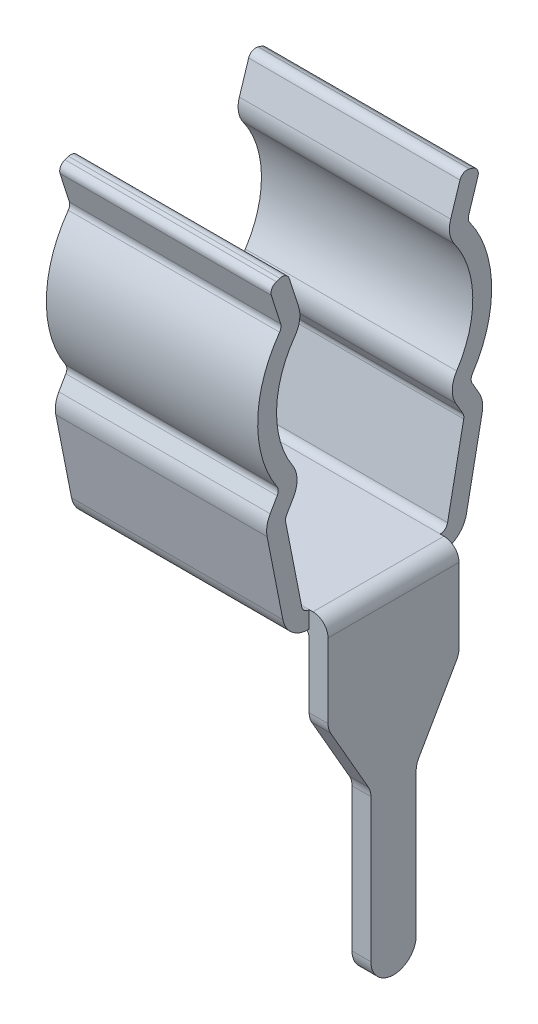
SolidWorks part; units mm, degrees
ref_plane "Plan de face" through (0, 0, 0) normal (0, 0, 1) x (1, 0, 0)
ref_plane "Plan de dessus" through (0, 0, 0) normal (0, 1, 0) x (1, 0, 0)
ref_plane "Plan de droite" through (0, 0, 0) normal (1, 0, 0) x (0, 0, -1)
sketch "Esquisse1" plane through (0, 0, 0) normal (1, 0, 0) x (0, 0, -1)
  line L0 (0, -44.9662) -> (0, 21.2612) construction
  line L1 (-24.6826, 0) -> (15.1517, 0) construction
  line L2 (-24.6826, 8.5) -> (15.1517, 8.5) construction
  line L3 (-24.6826, -8.5) -> (15.1517, -8.5) construction
  line L4 (11.7413, 5.4) -> (-3.8533, 5.4) construction
  line L5 (1.9, 11.6767) -> (1.9, -1.9759) construction
  line L6 (-1.9, 11.6767) -> (-1.9, -1.9759) construction
  line L7 (-1.9, 3.6704) -> (-3.7603, 0.4482) construction
  line L8 (-2.4394, 3.7362) -> (-4.4719, 0.2157) construction
  line L9 (4.6088, 0.4482) -> (-6.7435, 0.4482) construction
  line L10 (-2.5206, 3.5954) -> (-1.9, 0.4482) construction
  line L11 (-2.3212, 0) -> (-3.0082, 3.4838) construction
  line L12 (-1.9, 7.1748) -> (-2.3212, 8.5) construction
  line L13 (-2.3212, 8.5) -> (-5.9253, 7.3544) construction
  line L14 (-2.2658, 6.6752) -> (-2.8459, 8.5) construction
  line L15 (1.7458, 0) -> (-1.7458, 0)
  line L16 (-2.4326, 0.5646) -> (-2.8497, 2.6796)
  line L17 (-2.7691, 3.1651) -> (-2.5837, 3.4863)
  line L18 (-2.0146, 7.5352) -> (-2.2607, 8.3094)
  line L19 (2.7372, 8.1579) -> (2.4911, 7.3838)
  line L20 (-2.3591, 2.7764) -> (-1.9318, 0.6095)
  line L21 (-1.7356, 0.4482) -> (1.7356, 0.4482)
  line L22 (-2.5118, 8.4394) -> (-2.6071, 8.4091)
  line L23 (-2.7372, 8.1579) -> (-2.4911, 7.3838)
  line L24 (-2.1507, 3.2363) -> (-2.3361, 2.9151)
  line L25 (2.5118, 8.4394) -> (2.6071, 8.4091)
  line L26 (2.0146, 7.5352) -> (2.2607, 8.3094)
  line L27 (2.7691, 3.1651) -> (2.5837, 3.4863)
  line L28 (2.1507, 3.2363) -> (2.3361, 2.9151)
  line L29 (2.4326, 0.5646) -> (2.8497, 2.6796)
  line L30 (2.3591, 2.7764) -> (1.9318, 0.6095)
  arc A0 (-2.1128, 6.9152) -> (-2.1721, 3.971) centre (0, 5.4) ccw
  arc A1 (-2.5191, 7.2066) -> (-2.5898, 3.6962) centre (0, 5.4) ccw
  arc A2 (-1.9318, 0.6095) -> (-1.7356, 0.4482) centre (-1.7356, 0.6482) ccw
  arc A3 (-2.3361, 2.9151) -> (-2.3591, 2.7764) centre (-2.1629, 2.8151) ccw
  arc A4 (-2.5898, 3.6962) -> (-2.5837, 3.4863) centre (-2.7569, 3.5863) cw
  arc A5 (-2.5191, 7.2066) -> (-2.4911, 7.3838) centre (-2.6817, 7.3232) ccw
  arc A6 (-2.2607, 8.3094) -> (-2.5118, 8.4394) centre (-2.4513, 8.2488) ccw
  arc A7 (-2.6071, 8.4091) -> (-2.7372, 8.1579) centre (-2.5466, 8.2185) ccw
  arc A8 (-2.0146, 7.5352) -> (-2.1128, 6.9152) centre (-2.6817, 7.3232) cw
  arc A9 (-1.7458, 0) -> (-2.4326, 0.5646) centre (-1.7458, 0.7) cw
  arc A10 (-2.1721, 3.971) -> (-2.1507, 3.2363) centre (-2.7569, 3.5863) cw
  arc A11 (-2.8497, 2.6796) -> (-2.7691, 3.1651) centre (-2.1629, 2.8151) cw
  arc A12 (2.5191, 7.2066) -> (2.4911, 7.3838) centre (2.6817, 7.3232) cw
  arc A13 (2.6071, 8.4091) -> (2.7372, 8.1579) centre (2.5466, 8.2185) cw
  arc A14 (2.2607, 8.3094) -> (2.5118, 8.4394) centre (2.4513, 8.2488) cw
  arc A15 (2.0146, 7.5352) -> (2.1128, 6.9152) centre (2.6817, 7.3232) ccw
  arc A16 (2.5191, 7.2066) -> (2.5898, 3.6962) centre (0, 5.4) cw
  arc A17 (2.5898, 3.6962) -> (2.5837, 3.4863) centre (2.7569, 3.5863) ccw
  arc A18 (2.8497, 2.6796) -> (2.7691, 3.1651) centre (2.1629, 2.8151) ccw
  arc A19 (2.1128, 6.9152) -> (2.1721, 3.971) centre (0, 5.4) cw
  arc A20 (2.1721, 3.971) -> (2.1507, 3.2363) centre (2.7569, 3.5863) ccw
  arc A21 (2.3361, 2.9151) -> (2.3591, 2.7764) centre (2.1629, 2.8151) cw
  arc A22 (1.7458, 0) -> (2.4326, 0.5646) centre (1.7458, 0.7) ccw
  arc A23 (1.9318, 0.6095) -> (1.7356, 0.4482) centre (1.7356, 0.6482) cw
  point P43 (-2.3736, 2.85)
  point P49 (-2.4601, 7.2863)
  point P55 (-2.7977, 8.3485)
  point P64 (-1.9161, 3.6425)
  point P67 (-2.9005, 2.9375)
  point P92 (0, 0)
  point P95 (0, 0.4482)
  dimension "D4" = 1.9
  dimension "D11" = 0.2
  dimension "D12" = 0.7
  dimension "D1" = 3.1
  dimension "D2" = 8.5
  dimension "D3" = 8.5
  dimension "D5" = 3.8
  dimension "D6" = 30
  dimension "D9" = 0.5
  dimension "D10" = 90
extrude "Boss.-Extru.1" add sketch "Esquisse1" along normal blind 5.6
sketch "Esquisse2" plane through (5.6, 0, 0) normal (1, 0, 0) x (0, 0, -1)
  line L0 (0, 1.4372) -> (0, -9.7791) construction
  line L1 (-4.0276, 0.4482) -> (2.783, 0.4482) construction
  line L2 (-4.0276, -8.5518) -> (2.783, -8.5518) construction
  line L3 (-1.7356, 1.8653) -> (-1.7356, -3.0129) construction
  line L4 (-0.6, -2.4733) -> (-0.6, -8.949) construction
  line L5 (-1.7356, -2.0518) -> (-0.0649, -4.9455) construction
  line L6 (-2.6218, -2.0518) -> (2.783, -2.0518) construction
  line L7 (-2.4479, -7.9518) -> (2.783, -7.9518) construction
  line L8 (-0.6, -7.9518) -> (-0.6, -4.1599)
  line L9 (-0.6666, -3.9106) -> (-1.669, -2.1675)
  line L10 (1.7356, 0.4482) -> (-1.7356, 0.4482)
  line L11 (-1.7356, 0.4482) -> (-1.7356, -1.9183)
  line L12 (0.6, -7.9518) -> (0.6, -4.1599)
  line L13 (0.6666, -3.9106) -> (1.669, -2.1675)
  line L14 (1.7356, 0.4482) -> (1.7356, -1.9183)
  arc A0 (-0.6, -7.9518) -> (0.6, -7.9518) centre (0, -7.9518) ccw
  arc A1 (-1.669, -2.1675) -> (-1.7356, -1.9183) centre (-1.2356, -1.9183) cw
  arc A2 (-0.6, -4.1599) -> (-0.6666, -3.9106) centre (-1.1, -4.1599) ccw
  arc A3 (0.6, -4.1599) -> (0.6666, -3.9106) centre (1.1, -4.1599) cw
  arc A4 (1.669, -2.1675) -> (1.7356, -1.9183) centre (1.2356, -1.9183) ccw
  point P30 (-0.6, -4.0264)
  point P38 (0, 0.4482)
  dimension "D5" = 0.5
  dimension "D1" = 0.6
  dimension "D2" = 9
  dimension "D3" = 2.5
  dimension "D4" = 30
extrude "Boss.-Extru.2" add sketch "Esquisse2" along normal blind 0.5
fillet "Congé1" radius 0.4 1 edges at (6.1, 0.4482, 0)
fillet "Congé2" radius 0.2 1 edges at (5.6, 0, 0)
